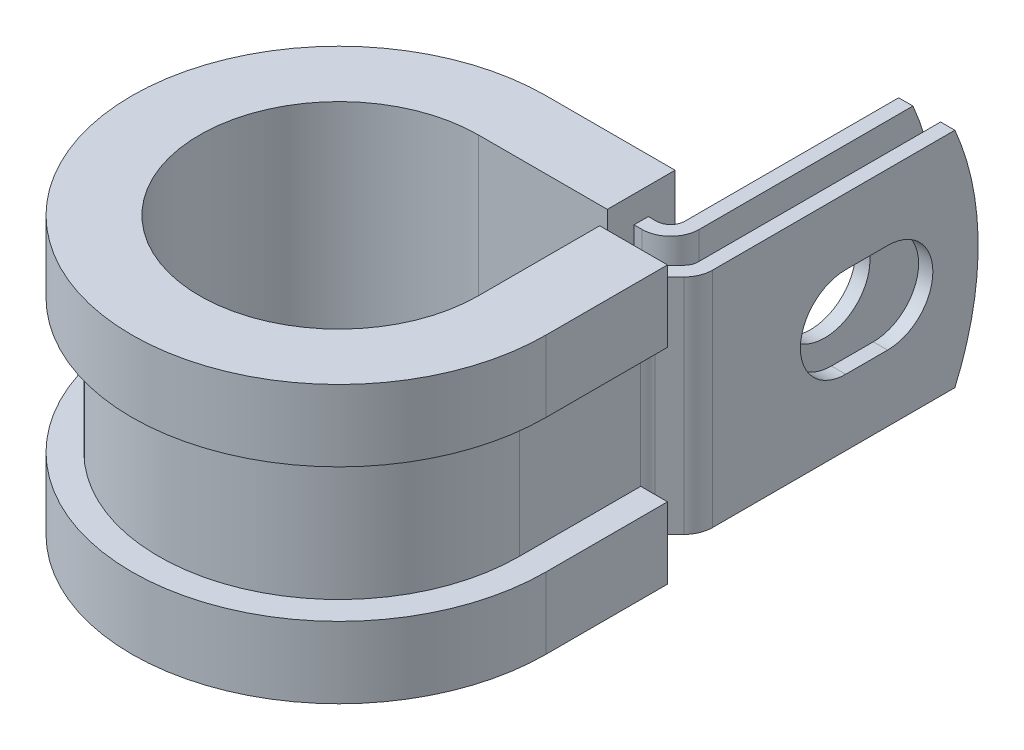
SolidWorks part; units mm, degrees
ref_plane "Front Plane" through (0, 0, 0) normal (0, 0, 1) x (1, 0, 0)
ref_plane "Top Plane" through (0, 0, 0) normal (0, 1, 0) x (1, 0, 0)
ref_plane "Right Plane" through (0, 0, 0) normal (1, 0, 0) x (0, 0, -1)
sketch "Sketch1" plane through (0, 0, 0) normal (0, 1, 0) x (1, 0, 0)
  line L0 (0, 9.4615) -> (7.8015, 9.4615)
  line L1 (9.4615, 0) -> (9.4615, 6.9111)
  line L2 (9.4271, 24.5872) -> (9.4271, 11.0871)
  line L3 (9.9376, 8.0606) -> (10.7638, 8.8868)
  line L5 (11.0019, 9.4615) -> (11.0019, 24.5872)
  arc A0 (0, 9.4615) -> (9.4615, 0) centre (0, 0) ccw
  arc A1 (9.9376, 8.0606) -> (9.4615, 6.9111) centre (11.0871, 6.9111) ccw
  arc A2 (10.7638, 8.8868) -> (11.0019, 9.4615) centre (10.1891, 9.4615) ccw
  arc A3 (7.8015, 9.4615) -> (9.4271, 11.0871) centre (7.8015, 11.0871) ccw
extrude "Extrude-Thin1" add sketch "Sketch1" along normal mid plane 12.7 thin
sketch "Sketch2" plane through (8.6143, 0, 0) normal (-1, 0, 0) x (0, 0, 1)
  line L0 (-24.5872, 6.35) -> (-24.5872, -6.35) construction
  line L1 (0, 6.35) -> (0, -6.35) construction
  circle A0 centre (-18.2372, 0) radius 2.5781
  point P2 (-24.5872, 0)
extrude "Cut-Extrude1" cut sketch "Sketch2" against normal up to surface (0.8128 mm away)
sketch "Sketch3" plane through (11.8147, 0, 0) normal (1, 0, 0) x (0, 0, -1)
  line L0 (17.0434, 0) -> (19.431, 0) construction
  line L1 (17.0434, 2.5781) -> (19.431, 2.5781)
  line L2 (17.0434, -2.5781) -> (19.431, -2.5781)
  line L3 (24.5872, 6.35) -> (24.5872, -6.35) construction
  arc A0 (17.0434, 2.5781) -> (17.0434, -2.5781) centre (17.0434, 0) ccw
  arc A1 (19.431, -2.5781) -> (19.431, 2.5781) centre (19.431, 0) ccw
  point P3 (18.2372, 0)
  point P8 (24.5872, 0)
  point P11 (14.4653, 0)
  point P12 (22.0091, 0)
extrude "Cut-Extrude2" cut sketch "Sketch3" against normal up to surface (0.8128 mm away)
sketch "Sketch4" plane through (8.6143, 0, 0) normal (-1, 0, 0) x (0, 0, 1)
  line L0 (-24.5872, 6.35) -> (-24.5872, -6.35)
  line L1 (-24.5872, 6.35) -> (-23.2619, 6.35)
  line L2 (-24.5872, 6.35) -> (-11.0871, 6.35) construction
  line L3 (-24.5872, -6.35) -> (-23.2619, -6.35)
  line L4 (-24.5872, -6.35) -> (-11.0871, -6.35) construction
  arc A0 (-23.2619, 6.35) -> (-23.2619, -6.35) centre (-8.7122, 0) ccw
extrude "Cut-Extrude3" cut sketch "Sketch4" against normal through all contours A0 M4 M5 | A0 L0 M2
ref_plane "Plane1" through (0, 0, -6.9111) normal (0, 0, -1) x (-1, 0, 0)
ref_plane "Plane2" through (7.3443, 0, 0) normal (-1, 0, 0) x (0, 0, 1)
sketch "Sketch5" plane through (0, 0, -6.9111) normal (0, 0, -1) x (-1, 0, 0)
  line L0 (-10.2743, 6.35) -> (-9.4615, 6.35)
  line L1 (-10.2743, 6.35) -> (-10.2743, -6.35) construction
  line L3 (-9.4615, 6.35) -> (-9.4615, -6.35)
  line L4 (-9.4615, -6.35) -> (-10.2743, -6.35)
  line L5 (-10.2743, -6.35) -> (-10.2743, -3.81)
  line L6 (-10.2743, 6.35) -> (-10.2743, 3.81)
  line L7 (-11.7983, 7.874) -> (-11.7983, 3.81)
  line L8 (-11.7983, 7.874) -> (-7.9375, 7.874)
  line L9 (-7.9375, 7.874) -> (-7.9375, -7.874)
  line L10 (-7.9375, -7.874) -> (-11.7983, -7.874)
  line L11 (-11.7983, -7.874) -> (-11.7983, -3.81)
  line L12 (-11.7983, 3.81) -> (-10.2743, 3.81)
  line L13 (-10.2743, -3.81) -> (-11.7983, -3.81)
sketch "Sketch6" plane through (0, 6.35, 0) normal (0, 1, 0) x (1, 0, 0)
  line L0 (7.9375, 0) -> (7.9375, 6.9111)
  line L1 (7.9375, 6.9111) -> (11.7983, 6.9111) construction
  line L2 (7.3443, 6.9878) -> (7.3443, -6.9878) construction
  line L5 (0, 7.9375) -> (7.3443, 7.9375)
  arc A0 (0, 7.9375) -> (7.9375, 0) centre (0, 0) ccw
sweep "Sweep1" add profiles "Sketch5" path "Sketch6"
equation "\"D4@Sketch5\" = \"D1@Extrude-Thin1\""
equation "\"D5@Sketch5\" = \"D5@Extrude-Thin1\""
equation "\"D1@Sketch3\" = \"D2@Sketch2\""
equation "\"D7@Sketch1\" = \"D3@Sketch2\" + \"D1@Sketch3\""
equation "\"D1@Sketch1\" = \"D1@Sketch6\" + 2 * \"D3@Sketch5\""
equation "\"D1@Sketch4\" = ( \"D1@Extrude-Thin1\" + .125 ) * 2"
equation "\"D9@Sketch1\"= \"D5@Extrude-Thin1\""
equation "\"D8@Sketch1\"= 2 * \"D5@Extrude-Thin1\""
equation "\"D2@Sketch1\" = 2 * \"D5@Extrude-Thin1\""
equation "\"D2@Sketch3\" = \"D1@Sketch2\""
